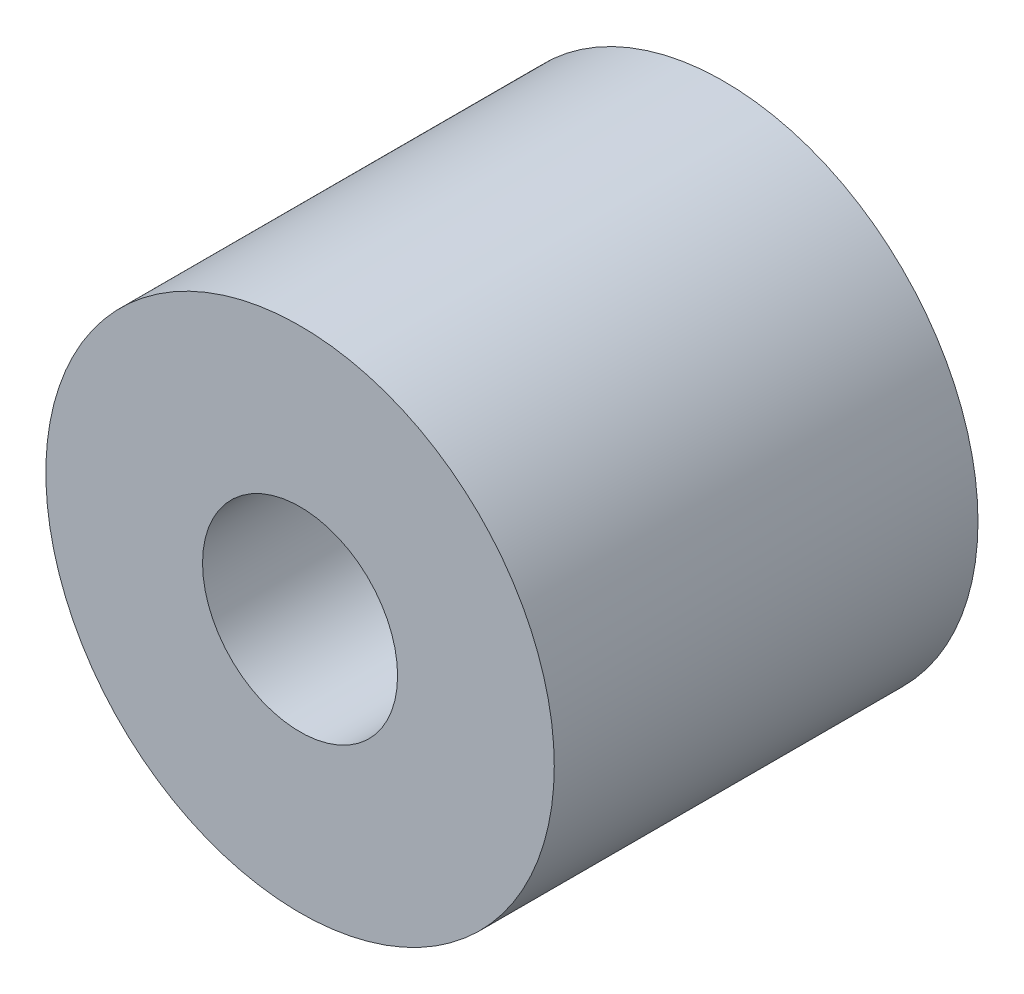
SolidWorks part; units mm, degrees
ref_plane "Face" through (0, 0, 0) normal (0, 0, 1) x (1, 0, 0)
ref_plane "Dessus" through (0, 0, 0) normal (0, 1, 0) x (1, 0, 0)
ref_plane "Droite" through (0, 0, 0) normal (1, 0, 0) x (0, 0, -1)
sketch "Esquisse1" plane through (0, 0, 0) normal (0, 0, 1) x (1, 0, 0)
  circle A0 centre (0, 0) radius 15
  dimension "D1" = 30
extrude "Extrusion1" add sketch "Esquisse1" along normal blind 25
hole_wizard "Trou taraudé 1/2-201" positions "Esquisse3" profile "Esquisse2" tap size "1/2-20" standard "PCS"
sketch "Esquisse3" plane through (0, 0, 25) normal (0, 0, 1) x (1, 0, 0)
  circle A0 centre (0, 0) radius 15 construction
  point P0 (0, 0)
sketch "Esquisse2" plane through (0, 0, 25) normal (1, 0, 0) x (0, -1, 0)
  line L0 (0, 0) -> (0, 25)
  line L1 (0, 25) -> (5.7544, 25)
  line L2 (5.7544, 25) -> (5.7544, 0)
  line L5 (5.7544, 0) -> (0, 0)
  line L11 (0, -6.35) -> (0, 107.95) construction
  dimension "Diamètre du trou pour taraudage jusqu'au prochain" = 11.5087
  dimension "Profondeur du trou pour taraudage jusqu'au prochain" = 25
